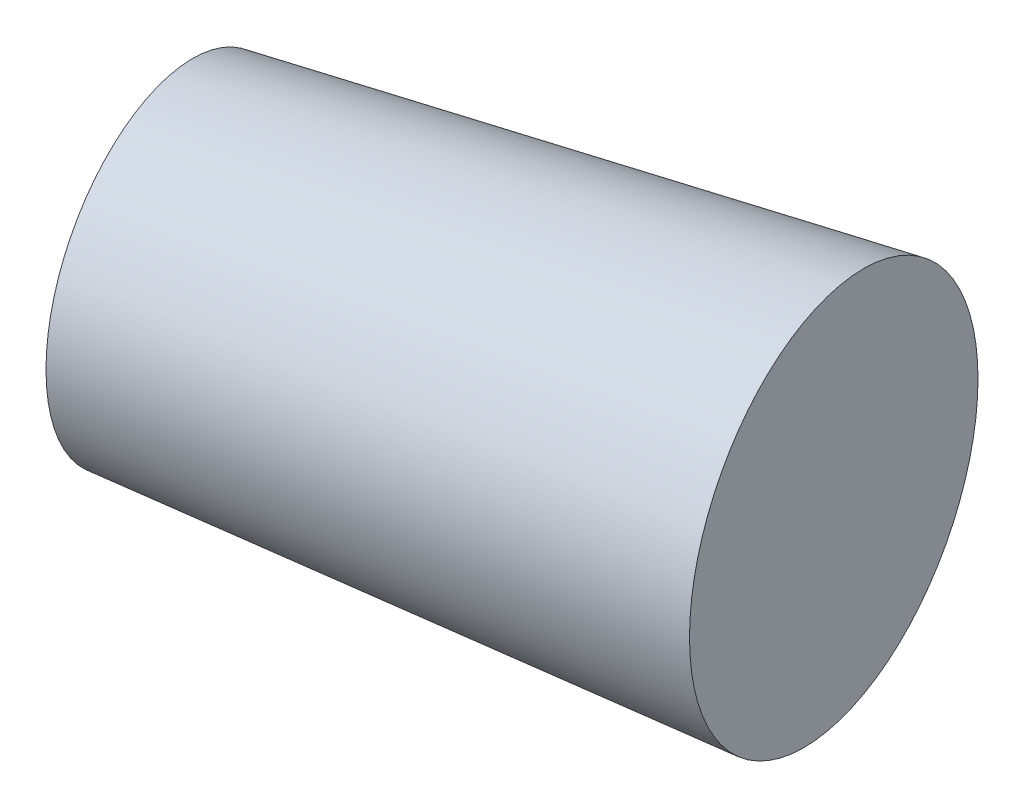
SolidWorks part; units mm, degrees
ref_plane "Plan1" through (0, 0, 0) normal (0, 0, 1) x (1, 0, 0)
ref_plane "Plan2" through (0, 0, 0) normal (0, 1, 0) x (1, 0, 0)
ref_plane "Plan3" through (0, 0, 0) normal (1, 0, 0) x (0, 0, -1)
sketch "Esquisse1" plane through (0, 0, 0) normal (0, 1, 0) x (1, 0, 0)
  line L1 (0, 0) -> (7.625, 1.6502) construction
  line L2 (0, 0) -> (7.625, 1.6502) construction
  line L4 (-5.5474, -4.1154) -> (-6.7526, 1.4535) construction
  line L5 (-6.7526, 1.4535) -> (2.9472, 4.091) construction
  line L6 (4.375, -2.5063) -> (2.9472, 4.091) construction
  line L7 (-6.15, -1.331) -> (3.6611, 0.7923)
  line L8 (-6.15, -1.331) -> (-6.7526, 1.4535)
  line L9 (-6.7526, 1.4535) -> (2.9472, 4.091)
  line L10 (3.6611, 0.7923) -> (2.9472, 4.091)
revolve "Base-Révolution" add sketch "Esquisse1" angle 360 about L2
